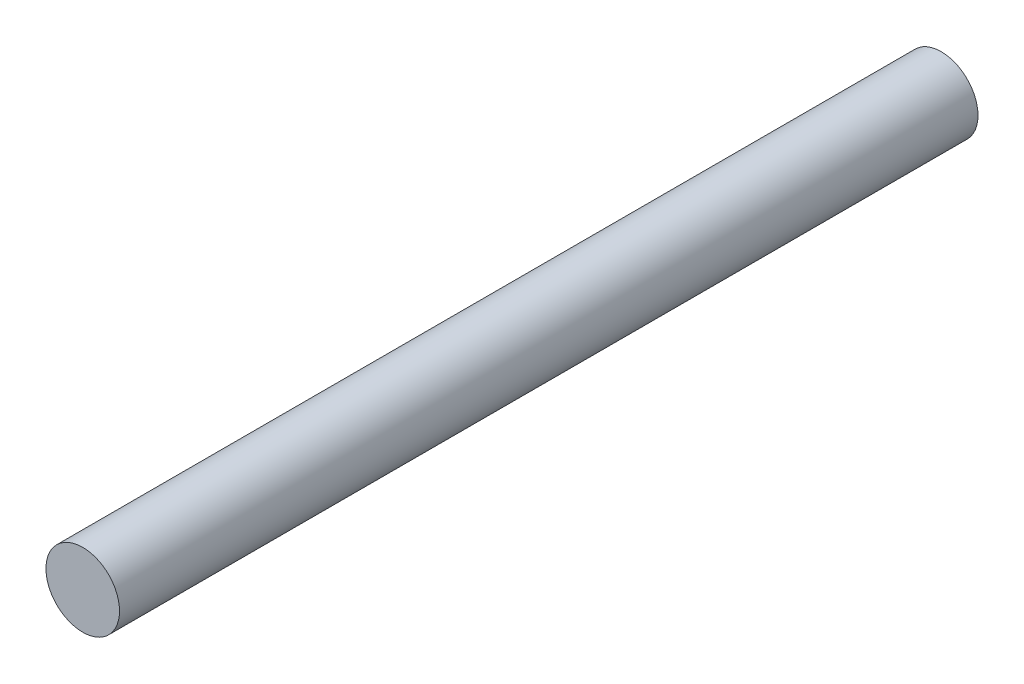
SolidWorks part; units mm, degrees
ref_plane "Plan de face" through (0, 0, 0) normal (0, 0, 1) x (1, 0, 0)
ref_plane "Plan de dessus" through (0, 0, 0) normal (0, 1, 0) x (1, 0, 0)
ref_plane "Plan de droite" through (0, 0, 0) normal (1, 0, 0) x (0, 0, -1)
sketch "Esquisse1" plane through (0, 0, 0) normal (0, 0, 1) x (1, 0, 0)
  circle A0 centre (0, 0) radius 1.5
  dimension "D1" = 3
extrude "Boss.-Extru.1" add sketch "Esquisse1" along normal blind 35
